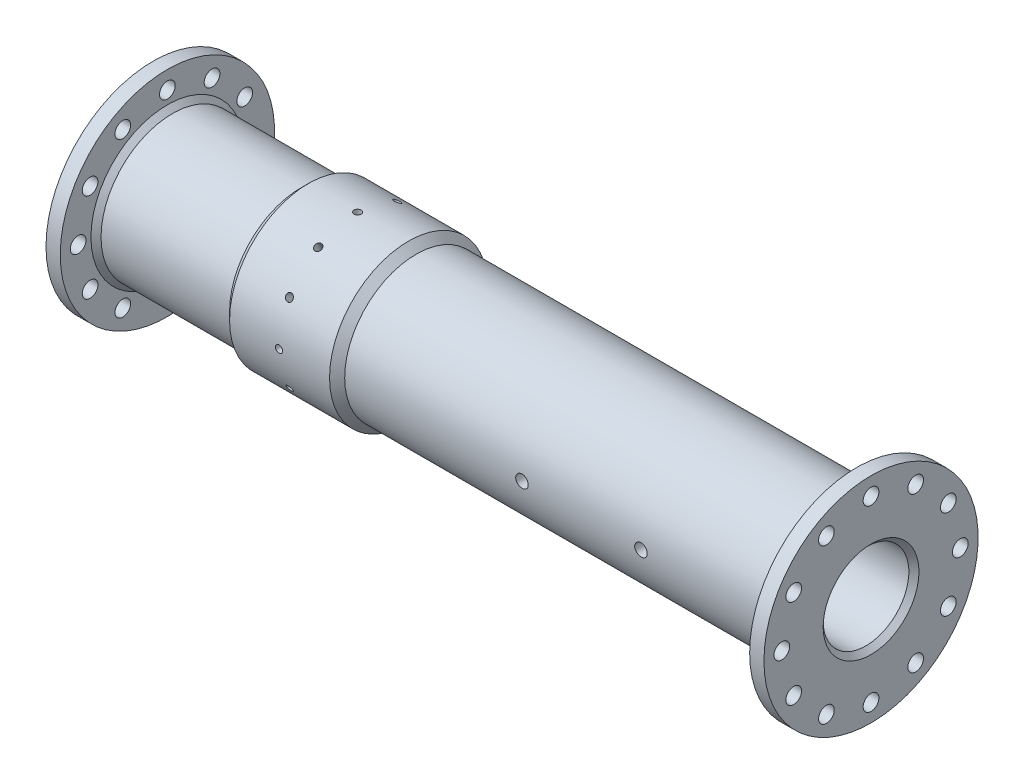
SolidWorks part; units mm, degrees
ref_plane "Front Plane" through (0, 0, 0) normal (0, 0, 1) x (1, 0, 0)
ref_plane "Top Plane" through (0, 0, 0) normal (0, 1, 0) x (1, 0, 0)
ref_plane "Right Plane" through (0, 0, 0) normal (1, 0, 0) x (0, 0, -1)
sketch "Sketch1" plane through (0, 0, 0) normal (0, 1, 0) x (1, 0, 0)
  line L0 (0, -134.669) -> (1081.1844, -134.669) construction
  line L2 (0, 15.331) -> (20, 15.331)
  line L3 (20, 15.331) -> (20, -27.5979)
  line L4 (20, -27.5979) -> (27.0711, -34.669)
  line L5 (27.0711, -34.669) -> (207.0711, -34.669)
  line L6 (207.0711, -34.669) -> (217.6777, -24.0624)
  line L7 (217.6777, -24.0624) -> (357.6777, -24.0624)
  line L8 (357.6777, -24.0624) -> (368.2843, -34.669)
  line L9 (368.2843, -34.669) -> (978.2843, -34.669)
  line L10 (978.2843, -34.669) -> (985.3553, -27.5979)
  line L11 (985.3553, -27.5979) -> (985.3553, 15.331)
  line L12 (985.3553, 15.331) -> (1005.3553, 15.331)
  line L14 (0, 15.331) -> (0, -67.5979)
  line L16 (1005.3553, -67.5979) -> (1005.3553, 15.331)
  line L17 (0, -67.5979) -> (7.0711, -74.669)
  line L18 (998.2843, -74.669) -> (1005.3553, -67.5979)
  line L19 (7.0711, -74.669) -> (483.5445, -74.669)
  line L20 (490.3849, -75.8752) -> (593.6563, -113.4629)
  line L21 (600.4967, -114.669) -> (633.4436, -114.669)
  line L22 (640.284, -113.4629) -> (743.5554, -75.8752)
  line L23 (750.3958, -74.669) -> (998.2843, -74.669)
  arc A0 (593.6563, -113.4629) -> (600.4967, -114.669) centre (600.4967, -94.669) ccw
  arc A1 (633.4436, -114.669) -> (640.284, -113.4629) centre (633.4436, -94.669) ccw
  arc A2 (743.5554, -75.8752) -> (750.3958, -74.669) centre (750.3958, -94.669) cw
  arc A3 (483.5445, -74.669) -> (490.3849, -75.8752) centre (483.5445, -94.669) cw
  point P37 (596.9702, -114.669)
  point P40 (636.9702, -114.669)
  point P45 (487.0711, -74.669)
  dimension "D25" = 20
  dimension "D2" = 20
  dimension "D3" = 45
  dimension "D4" = 10
  dimension "D5" = 45
  dimension "D6" = 10
  dimension "D7" = 150
  dimension "D8" = 20
  dimension "D9" = 10
  dimension "D10" = 10
  dimension "D11" = 20
  dimension "D12" = 180
  dimension "D13" = 140
  dimension "D14" = 15
  dimension "D15" = 15
  dimension "D16" = 20
  dimension "D17" = 40
  dimension "D18" = 40
  dimension "D19" = 40
  dimension "D20" = 40
  dimension "D21" = 480
  dimension "D22" = 45
  dimension "D23" = 50
  dimension "D24" = 610
revolve "Revolve2" add sketch "Sketch1" angle 360 about L0
hole_wizard "M20 Clearance Hole1" positions "Sketch4" profile "Sketch3" hole size "M20" standard "ANSI Metric"
sketch "Sketch4" plane through (0, 0, 0) normal (-1, 0, 0) x (0, 0, 1)
  circle A0 centre (134.669, 0) radius 125 construction
  point P0 (134.669, 125)
  dimension "D1" = 125
sketch "Sketch3" plane through (0, 125, 134.669) normal (0, 1, 0) x (0, 0, 1)
  line L0 (0, 0) -> (0, 1005.3553)
  line L1 (0, 1005.3553) -> (11, 1005.3553)
  line L2 (11, 1005.3553) -> (11, 0)
  line L5 (11, 0) -> (0, 0)
  line L11 (0, -6.35) -> (0, 107.95) construction
  dimension "Thru Hole Dia." = 22
  dimension "Thru Hole Depth" = 1005.3553
pattern_circular "CirPattern1" count 12 every 30 about axis through (0, 0, 134.669) along (1, 0, 0) of "M20 Clearance Hole1"
hole_wizard "Ø10.0mm Dowel Hole1" positions "3DSketch2" profile "Sketch6" hole size "Ø10.0" standard "ANSI Metric"
sketch3d "3DSketch2"
  point P0 (286.8823, -0.4553, 245.2747)
sketch "Sketch6" plane through (286.8823, -0.4553, 245.2747) normal (1, 0, 0) x (0, -1, -0.0041)
  line L0 (0, 0) -> (0, 192.6592)
  line L1 (0, 192.6592) -> (5, 192.6592)
  line L2 (5, 192.6592) -> (5, 0)
  line L5 (5, 0) -> (0, 0)
  line L11 (0, -6.35) -> (0, 107.95) construction
  dimension "Thru Hole Dia." = 10
  dimension "Thru Hole Depth" = 192.6592
pattern_circular "CirPattern2" count 12 every 30 about axis through (217.6777, 0, 134.669) along (-1, 0, 0) of "Ø10.0mm Dowel Hole1"
hole_wizard "Tap Drill for M20x2.5 Tap1" positions "3DSketch3" profile "Sketch7" hole size "M20x2.5" standard "ANSI Metric"
sketch3d "3DSketch3"
  line L0 (616.4938, -1.3658, 234.6597) -> (783.1306, -1.3658, 234.6597) construction
  point P0 (616.4938, -1.3658, 234.6597)
  point P2 (783.1306, -1.3658, 234.6597)
sketch "Sketch7" plane through (616.4938, -1.3658, 234.6597) normal (1, 0, 0) x (0, -0.9999, -0.0137)
  line L0 (0, 0) -> (0, 80)
  line L1 (0, 80) -> (8.75, 80)
  line L2 (8.75, 80) -> (8.75, 0)
  line L5 (8.75, 0) -> (0, 0)
  line L11 (0, -6.35) -> (0, 107.95) construction
  dimension "Thru Hole Dia." = 17.5
  dimension "Thru Hole Depth" = 80
